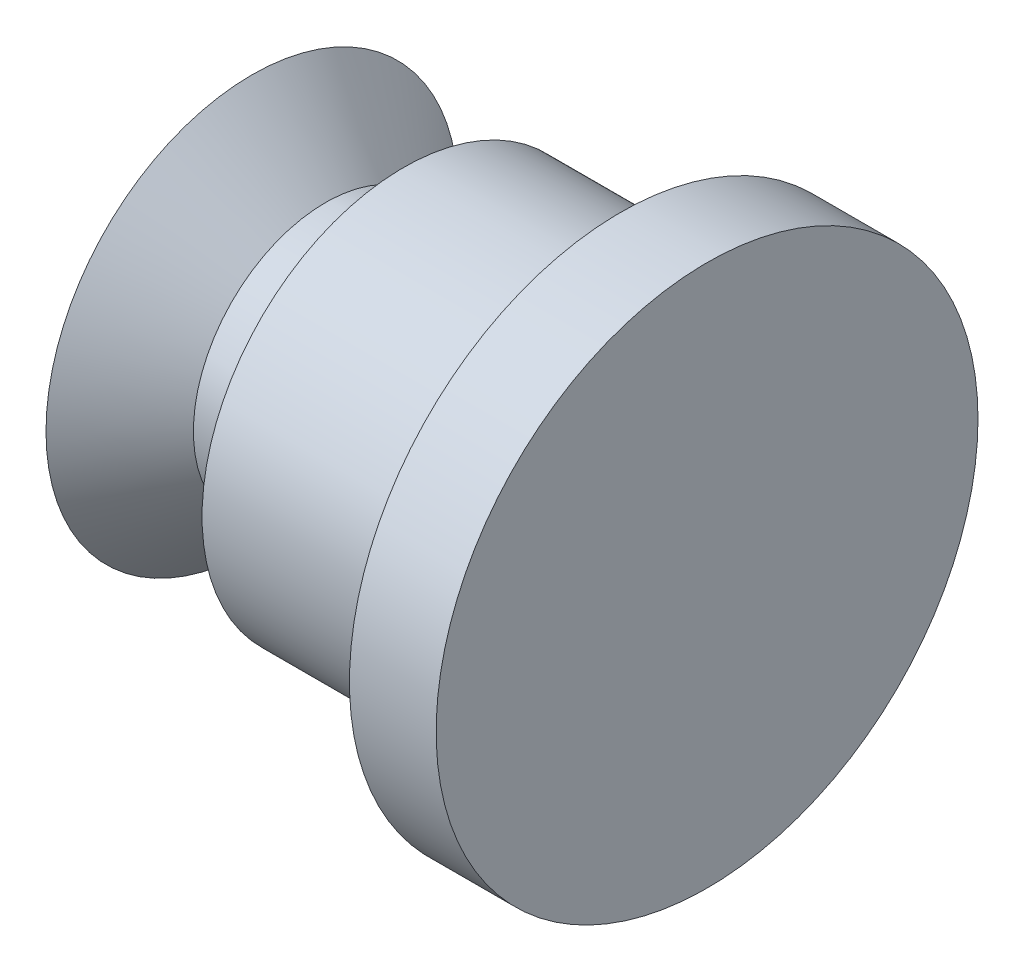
SolidWorks part; units mm, degrees
ref_plane "Front Plane" through (0, 0, 0) normal (0, 0, 1) x (1, 0, 0)
ref_plane "Top Plane" through (0, 0, 0) normal (0, 1, 0) x (1, 0, 0)
ref_plane "Right Plane" through (0, 0, 0) normal (1, 0, 0) x (0, 0, -1)
sketch "Sketch1" plane through (0, 0, 0) normal (0, 0, 1) x (1, 0, 0)
  line L0 (0, 0) -> (-4.6863, 0) construction
  line L1 (0, 0) -> (0, 3.175)
  line L2 (0, 3.175) -> (-1.016, 3.175)
  line L3 (-1.016, 3.175) -> (-1.016, 2.3622)
  line L4 (-1.016, 2.3622) -> (-3.556, 2.3622)
  line L5 (-3.556, 2.3622) -> (-3.556, 1.5494)
  line L6 (-3.556, 1.5494) -> (-4.4704, 1.5494)
  line L7 (-4.4704, 1.5494) -> (-5.334, 2.413)
  line L8 (-5.334, 2.413) -> (-5.334, 0)
  line L9 (-5.334, 0) -> (0, 0)
  point P3 (-4.6863, 0)
  point P12 (-3.9448, 1.5494)
  dimension "D1" = 6.35
  dimension "D2" = 4.7244
  dimension "D3" = 3.0988
  dimension "D4" = 4.826
  dimension "D5" = 4.318
  dimension "D6" = 1.016
  dimension "D7" = 2.54
  dimension "D8" = 45
revolve "Revolve1" add sketch "Sketch1" angle 360 about L0
